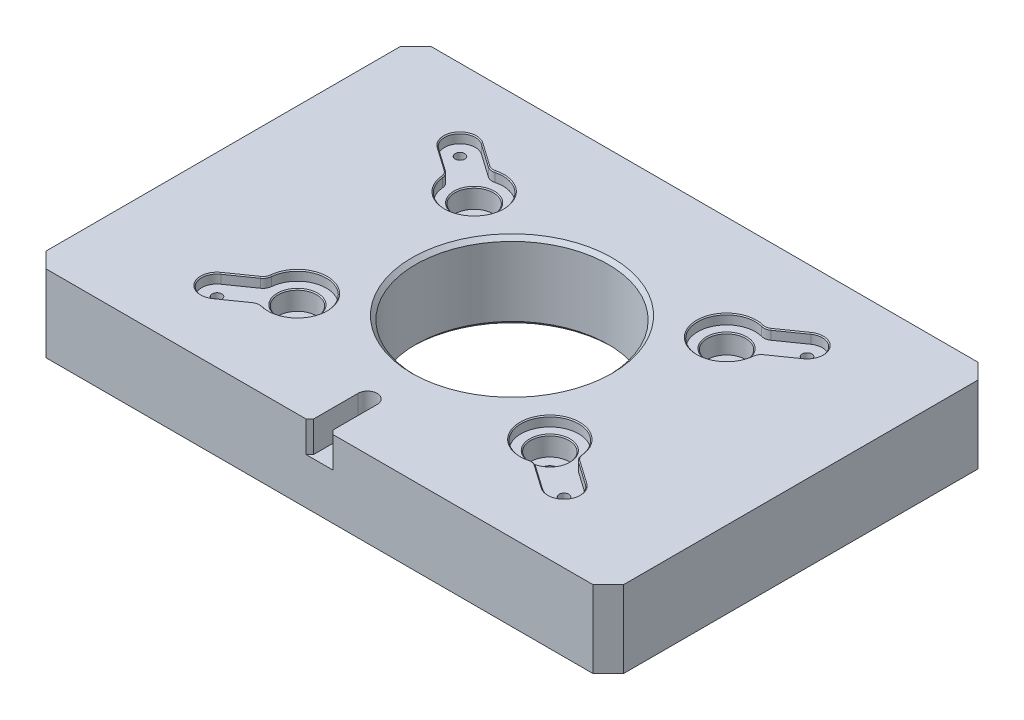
SolidWorks part; units mm, degrees
ref_plane "Front" through (0, 0, 0) normal (0, 0, 1) x (1, 0, 0)
ref_plane "Top" through (0, 0, 0) normal (0, 1, 0) x (1, 0, 0)
ref_plane "Right" through (0, 0, 0) normal (1, 0, 0) x (0, 0, -1)
sketch "Sketch1" plane through (0, 0, 0) normal (0, 1, 0) x (1, 0, 0)
  line L0 (-150, -100) -> (150, 100) construction
  line L1 (-150, 100) -> (150, 100)
  line L2 (-150, 100) -> (-150, -100)
  line L3 (-150, -100) -> (150, -100)
  line L4 (150, 100) -> (150, -100)
  circle A0 centre (0, 0) radius 50
  dimension "D3" = 100
  dimension "D1" = 300
  dimension "D2" = 200
extrude "Boss-Extrude1" add sketch "Sketch1" along normal blind 40
sketch "Sketch2" plane through (0, 40, 0) normal (0, 1, 0) x (1, 0, 0)
  line L0 (0, 0) -> (65.5322, -45.8861) construction
  line L1 (65.5322, -45.8861) -> (102.394, -71.6971) construction
  line L2 (0, 0) -> (72.1193, 0) construction
  line L3 (85.5181, -69.6466) -> (71.3374, -59.7172)
  line L4 (94.6953, -56.5402) -> (80.5146, -46.6108)
  arc A0 (80.5146, -46.6108) -> (71.3374, -59.7172) centre (65.5322, -45.8861) ccw
  circle A1 centre (0, 0) radius 80 construction
  arc A2 (94.6953, -56.5402) -> (85.5181, -69.6466) centre (90.1067, -63.0934) cw
  dimension "D1" = 30
  dimension "D3" = 160
  dimension "D2" = 35
  dimension "D4" = 16
  dimension "D5" = 30
extrude "Cut-Extrude1" cut sketch "Sketch2" against normal blind 5
fillet "Fillet1" radius 5 2 edges at (71.3374, 37.5, 59.7172) (80.5146, 37.5, 46.6108)
hole_wizard "M6 Tapped Hole1" positions "Sketch4" profile "Sketch3" tap size "M6" standard "ISO"
sketch "Sketch4" plane through (0, 35, 0) normal (0, 1, 0) x (1, 0, 0)
  point P0 (90.1067, -63.0934)
sketch "Sketch3" plane through (90.1067, 35, 63.0934) normal (1, 0, 0) x (0, 0, 1)
  line L0 (0, 0) -> (0, 18.5022)
  line L1 (0, 18.5022) -> (2.5, 17)
  line L2 (2.5, 17) -> (2.5, 0)
  line L5 (2.5, 0) -> (0, 0)
  line L10 (0, 18.5022) -> (-2.5, 17) construction
  line L11 (0, -6.35) -> (0, 107.95) construction
  dimension "Tap Drill Dia." = 5
  dimension "Tap Drill Depth" = 17
  dimension "Drill Angle" = 118
sketch "Sketch5" plane through (0, 35, 0) normal (0, 1, 0) x (1, 0, 0)
  circle A0 centre (65.5322, -45.8861) radius 10
  dimension "D1" = 20
extrude "Cut-Extrude2" cut sketch "Sketch5" against normal blind 10
chamfer "Chamfer2" distance 0.5 angle 45 7 edges at (96.6599, 40, 67.682) (88.6331, 40, 52.2953) (79.4558, 40, 65.4018) (81.1204, 40, 46.4752) (71.4172, 40, 60.3328) (53.2449, 40, 37.2825) (65.5322, 35, 55.8861)
chamfer "Chamfer1" distance 2 angle 45 2 edges at (0, 0, 50) (0, 40, 50)
hole_wizard "CBORE for M8 Hex Socket Head Cap Screw1" positions "Sketch7" profile "Sketch6" counterbore size "M8" standard "ISO"
sketch "Sketch7" plane through (0, 0, 0) normal (0, -1, 0) x (-1, 0, 0)
  point P0 (-65.5322, -45.8861)
sketch "Sketch6" plane through (65.5322, 0, 45.8861) normal (1, 0, 0) x (0, 0, -1)
  line L0 (0, 0) -> (0, 40)
  line L1 (0, 40) -> (4.5, 40)
  line L3 (4.5, 40) -> (4.5, 8.6)
  line L4 (4.5, 8.6) -> (7.5, 8.6)
  line L5 (7.5, 8.6) -> (7.5, 0)
  line L7 (7.5, 0) -> (0, 0)
  line L11 (0, -6.35) -> (0, 107.95) construction
  dimension "Thru Hole Dia." = 9
  dimension "Thru Hole Depth" = 40
  dimension "C'Bore Dia." = 15
  dimension "C'Bore Depth" = 8.6
mirror "Mirror1" about plane through (0, 0, 0) normal (0, 0, 1) of "CBORE for M8 Hex Socket Head Cap Screw1", "Cut-Extrude1", "Fillet1", "M6 Tapped Hole1", "Cut-Extrude2", "Chamfer2"
mirror "Mirror2" about plane through (0, 0, 0) normal (1, 0, 0) of "Mirror1", "Cut-Extrude1", "Fillet1", "M6 Tapped Hole1", "Cut-Extrude2", "Chamfer2", "CBORE for M8 Hex Socket Head Cap Screw1"
sketch "Sketch9" plane through (0, 40, 0) normal (0, 1, 0) x (1, 0, 0)
  line L0 (-150, -100) -> (150, -100) construction
  line L1 (-5, -100) -> (5, -100)
  line L2 (-5, -100) -> (-5, -75)
  line L3 (-5, -75) -> (5, -75) construction
  line L4 (5, -100) -> (5, -75)
  line L6 (0, -75) -> (0, 0) construction
  arc A0 (-5, -75) -> (5, -75) centre (0, -75) cw
  dimension "D1" = 25
  dimension "D2" = 10
extrude "Cut-Extrude3" cut sketch "Sketch9" against normal blind 16
chamfer "Chamfer3" distance 8 angle 45 4 edges at (-150, 20, -100) (150, 20, -100) (150, 20, 100) (-150, 20, 100)
chamfer "Chamfer4" distance 2 angle 45 2 edges at (5, 32, 100) (-5, 32, 100)
